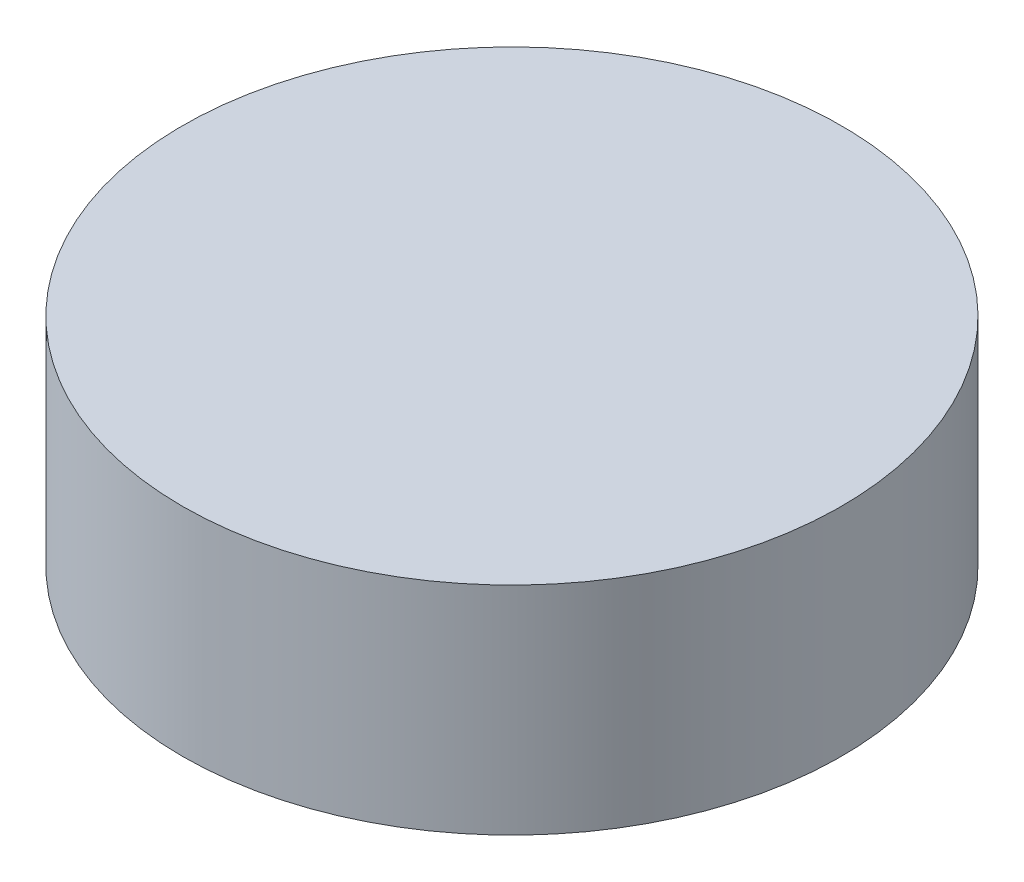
SolidWorks part; units mm, degrees
ref_plane "Front Plane" through (0, 0, 0) normal (0, 0, 1) x (1, 0, 0)
ref_plane "Top Plane" through (0, 0, 0) normal (0, 1, 0) x (1, 0, 0)
ref_plane "Right Plane" through (0, 0, 0) normal (1, 0, 0) x (0, 0, -1)
sketch "Sketch1" plane through (0, 0, 0) normal (0, 1, 0) x (1, 0, 0)
  circle A0 centre (0, 0) radius 8.89
  dimension "D1" = 17.78
extrude "Boss-Extrude1" add sketch "Sketch1" against normal mid plane 5.842 contours A0
sketch "Sketch2" plane through (0, -2.921, 0) normal (0, -1, 0) x (-1, 0, 0)
  circle A0 centre (0, 0) radius 3.81
  dimension "D1" = 7.62
extrude "Cut-Extrude1" cut sketch "Sketch2" against normal blind 5.08
equation "\".2.0in\"=2.3"
